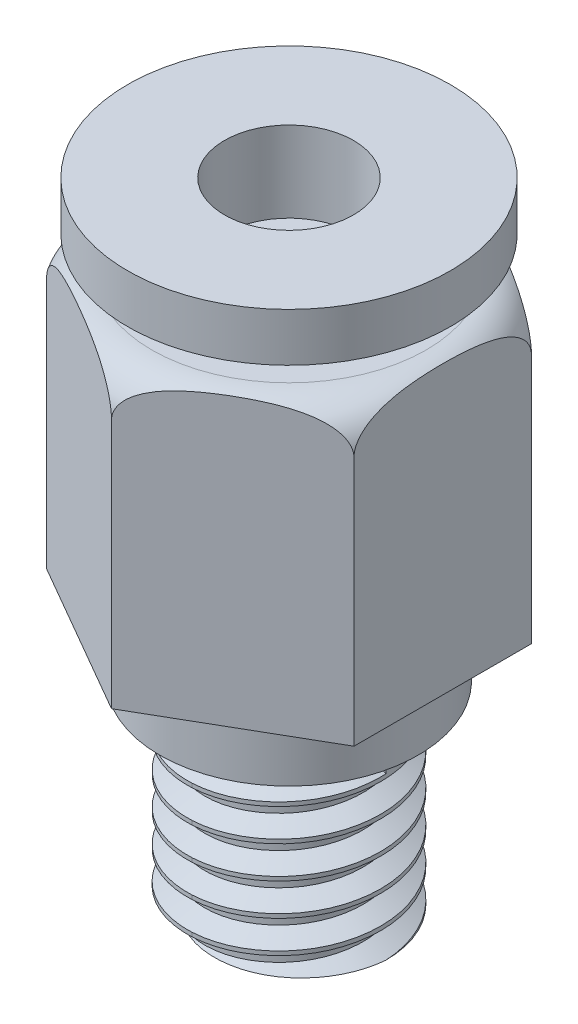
SolidWorks part; units mm, degrees
ref_plane "Спереди" through (0, 0, 0) normal (0, 0, 1) x (1, 0, 0)
ref_plane "Сверху" through (0, 0, 0) normal (0, 1, 0) x (1, 0, 0)
ref_plane "Справа" through (0, 0, 0) normal (1, 0, 0) x (0, 0, -1)
sketch "Эскиз1" plane through (0, 0, 0) normal (0, 0, 1) x (1, 0, 0)
  line L0 (0, 11.3332) -> (0, 0) construction
  line L1 (0, 0) -> (10.4375, 0) construction
  line L2 (1, 0) -> (1, 17)
  line L3 (1, 0) -> (3, 0)
  line L4 (3, 0) -> (3, 6)
  line L5 (3, 6) -> (4, 6)
  line L6 (4, 6) -> (4, 8)
  line L7 (4, 8) -> (5.5, 8)
  line L8 (5.5, 8) -> (5.5, 15.75)
  line L13 (4.25, 17) -> (1, 17)
  arc A0 (5.5, 15.75) -> (4.25, 17) centre (4.25, 15.75) ccw
  point P17 (5.5, 17)
  dimension "D6" = 1.25
  dimension "D1" = 2
  dimension "D2" = 6
  dimension "D3" = 6
  dimension "D4" = 2
  dimension "D5" = 9
  dimension "D7" = 11
  dimension "D8" = 8
revolve "Повернуть1" add sketch "Эскиз1" angle 360 about L0
sketch "Эскиз2" plane through (0, 17, 0) normal (0, 1, 0) x (1, 0, 0)
  line L0 (0, 7.4016) -> (0, 0) construction
  line L1 (0, 0) -> (6.774, 0) construction
  line L3 (0, 5.5) -> (-4.7631, 2.75)
  line L4 (-4.7631, 2.75) -> (-4.7631, -2.75)
  line L5 (-4.7631, -2.75) -> (0, -5.5)
  line L6 (0, -5.5) -> (4.7631, -2.75)
  line L7 (4.7631, -2.75) -> (4.7631, 2.75)
  line L8 (4.7631, 2.75) -> (0, 5.5)
  circle A0 centre (0, 0) radius 4.7631 construction
  circle A1 centre (0, 0) radius 5.5
  circle A2 centre (0, 0) radius 5.5 construction
extrude "Вырез-Вытянуть1" cut sketch "Эскиз2" against normal up to surface (9 mm away) contours L4 A1 | L3 A1 | L8 A1 | L7 A1 | L6 A1 | L5 A1
thread "Резьба1" pitch 1 start angle 0, offset 1, length 6, pitch 1, diameter 6
ref_plane "Плоскость1" through (3, -1, 0) normal (0, 0, 1) x (1, 0, 0)
sketch "Профиль резьбы1" plane through (3, -1, 0) normal (0, 0, 1) x (1, 0, 0)
  line L0 (0, 0) -> (0, 1) construction
  line L11 (0, 0) -> (0, 0.875)
  line L12 (0, 0.875) -> (-0.5413, 0.5625)
  line L13 (-0.5413, 0.5625) -> (-0.5413, 0.3125)
  line L15 (-0.5413, 0.3125) -> (0, 0)
  line L17 (-0.5413, 0.4375) -> (0, 0.4375) construction
  point P2 (0, 0)
  dimension "Pitch" = 1
  dimension "Profile_Angle" = 60
  dimension "Profile_Land" = 0.25
  dimension "Profile_Height" = 0.5413
sketch "Эскиз6" plane through (0, 0, 0) normal (0, 0, 1) x (1, 0, 0)
  line L0 (0, 0) -> (0, 22.4155) construction
  line L1 (2, 17) -> (2, 19.5)
  line L2 (2, 19.5) -> (5, 19.5)
  line L3 (5, 19.5) -> (5, 18)
  line L4 (5, 18) -> (2.5, 18)
  line L5 (2.5, 18) -> (2.5, 17)
  line L6 (4.25, 17) -> (-4.25, 17) construction
  line L7 (2.5, 17) -> (2, 17)
  dimension "D1" = 5
  dimension "D2" = 10
  dimension "D3" = 2.5
  dimension "D4" = 1.5
  dimension "D5" = 4
revolve "Повернуть2" add sketch "Эскиз6" angle 360 about L0
